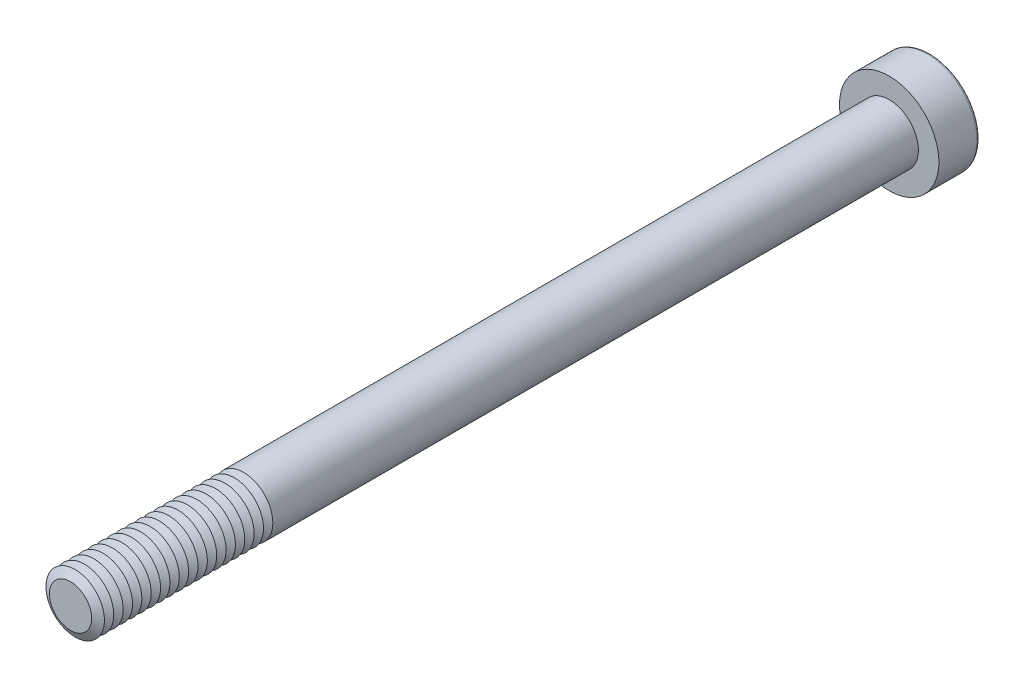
SolidWorks part; units mm, degrees
ref_plane "Front Plane" through (0, 0, 0) normal (0, 0, 1) x (1, 0, 0)
ref_plane "Top Plane" through (0, 0, 0) normal (0, 1, 0) x (1, 0, 0)
ref_plane "Right Plane" through (0, 0, 0) normal (1, 0, 0) x (0, 0, -1)
sketch "Sketch1" plane through (0, 0, 0) normal (0, 0, 1) x (1, 0, 0)
  circle A0 centre (0, 0) radius 2.5
  dimension "D1" = 5
extrude "Boss-Extrude1" add sketch "Sketch1" along normal blind 70
sketch "Sketch2" plane through (0, 0, 0) normal (0, 0, -1) x (-1, 0, 0)
  circle A0 centre (0, 0) radius 4.25
  dimension "D1" = 8.5
extrude "Boss-Extrude2" add sketch "Sketch2" along normal blind 3.5
sketch "Sketch3" plane through (0, 0, -3.5) normal (0, 0, -1) x (-1, 0, 0)
  line L1 (-0.866, 1.5) -> (-1.7321, 0)
  line L2 (-1.7321, 0) -> (-0.866, -1.5)
  line L3 (-0.866, -1.5) -> (0.866, -1.5)
  line L4 (0.866, -1.5) -> (1.7321, 0)
  line L5 (1.7321, 0) -> (0.866, 1.5)
  line L6 (0.866, 1.5) -> (-0.866, 1.5)
  circle A0 centre (0, 0) radius 1.5 construction
  dimension "D1" = 3
extrude "Cut-Extrude1" cut sketch "Sketch3" against normal blind 2.25
fillet "Fillet1" radius 0.25 1 edges at (-4.25, 0, -3.5)
sketch "Sketch4" plane through (0, 0, -1.25) normal (0, 0, -1) x (-1, 0, 0)
  line L0 (0.866, -1.5) -> (1.7321, 0) construction
  circle A0 centre (0, 0) radius 1.5
extrude "Cut-Extrude2" cut sketch "Sketch4" against normal through all draft 60
sketch "Sketch5" plane through (0, 0, -3.5) normal (0, 0, -1) x (-1, 0, 0)
  circle A0 centre (0, 0) radius 1.7321
extrude "Cut-Extrude3" cut sketch "Sketch5" against normal through all draft 75
sketch "Sketch7" plane through (0, 0, 0) normal (1, 0, 0) x (0, 0, -1)
  line L25 (-70, 1.8072) -> (-69.6, 2.5)
  line L26 (-70, 2.5) -> (-70, -2.5) construction
  line L27 (-69.6, 2.5) -> (-70.4, 2.5)
  line L28 (-70.4, 2.5) -> (-70, 1.8072)
  line L29 (0, 2.5) -> (-70, 2.5) construction
  dimension "D1" = 0.8
revolve "Cut-Revolve1" cut sketch "Sketch7" angle 360 about axis through (0, 0, 70) along (0, 0, -1)
pattern_linear "LPattern1" count 19 spacing 0.8 along (0, 0, -1) of "Cut-Revolve1"
